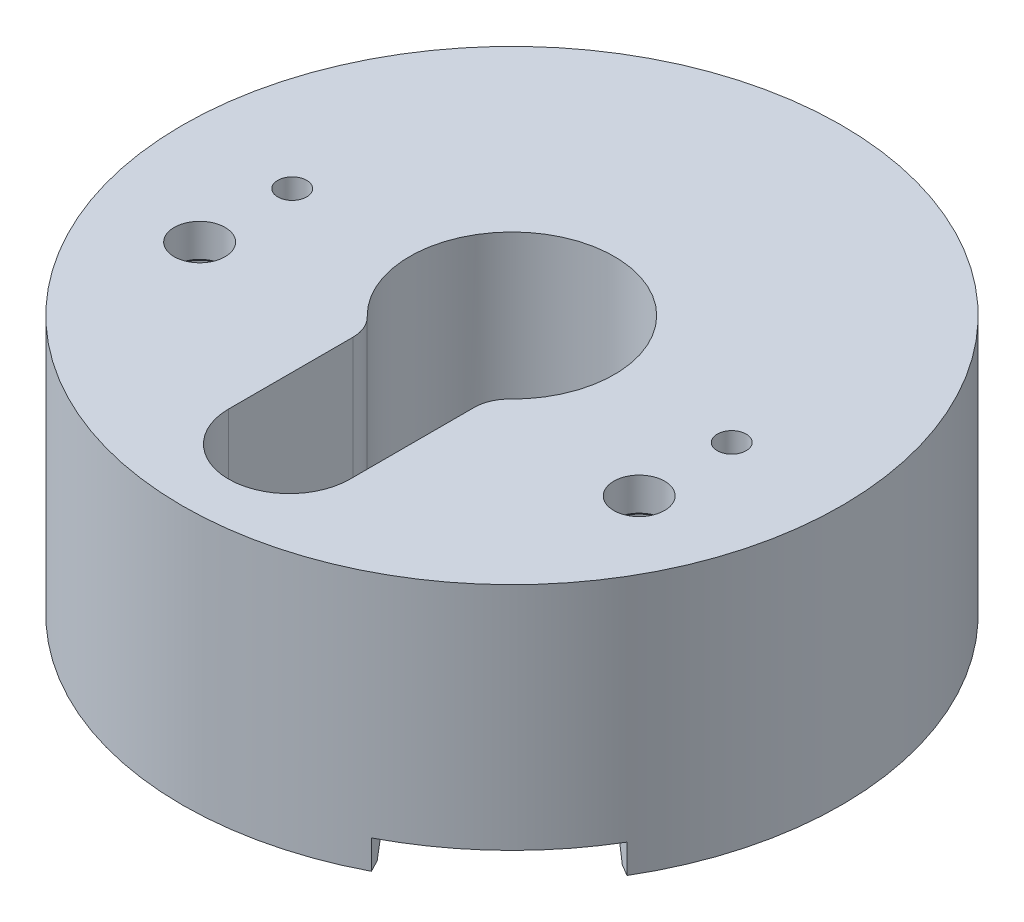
SolidWorks part; units mm, degrees
ref_plane "XY - Vorne" through (0, 0, 0) normal (0, 0, 1) x (1, 0, 0)
ref_plane "XZ - Oben" through (0, 0, 0) normal (0, 1, 0) x (1, 0, 0)
ref_plane "YZ - Rechts" through (0, 0, 0) normal (1, 0, 0) x (0, 0, -1)
sketch "Skizze1" plane through (0, 0, 0) normal (0, 1, 0) x (1, 0, 0)
  circle A0 centre (0, 0) radius 28.5
  dimension "D1" = 57
extrude "Aufsatz-Linear austragen1" add sketch "Skizze1" along normal blind 22.4
sketch "Skizze2" plane through (0, 0, 0) normal (0, -1, 0) x (1, 0, 0)
  circle A0 centre (0, 0) radius 27.325
  circle A1 centre (0, 0) radius 28.5 construction
  dimension "D1" = 54.65
extrude "Schnitt-Linear austragen1" cut sketch "Skizze2" against normal blind 2.5 draft 27
sketch "Skizze3" plane through (0, 22.4, 0) normal (0, 1, 0) x (1, 0, 0)
  circle A0 centre (0, 0) radius 25.35
  circle A1 centre (0, 0) radius 28.5 construction
  dimension "D1" = 50.7
extrude "Schnitt-Linear austragen2" [suppressed] cut sketch "Skizze3" against normal blind 2
sketch "Skizze4" plane through (0, 2.5, 0) normal (0, -1, 0) x (-1, 0, 0)
  line L0 (-19, 0) -> (19, 0) construction
  line L2 (0, 0) -> (0, -1.9579) construction
  point P0 (-19, 0)
  point P2 (19, 0)
  dimension "D1" = 38
hole_wizard "Ø2.5 (2.5) Durchmesser Bohrung1" positions "Skizze4" profile "Skizze5" hole size "Ø2.5" standard "DIN"
sketch "Skizze5" plane through (19, 2.5, 0) normal (1, 0, 0) x (0, 0, -1)
  line L0 (0, 0) -> (0, 19.9)
  line L1 (0, 19.9) -> (1.25, 19.9)
  line L2 (1.25, 19.9) -> (1.25, 0.15)
  line L3 (1.25, 0.15) -> (1.4, 0)
  line L5 (1.4, 0) -> (0, 0)
  line L6 (-1.25, 0.15) -> (-1.4, 0) construction
  line L11 (0, -6.35) -> (0, 107.95) construction
  dimension "Bohrerdurchmesser" = 2.5
  dimension "Bohrungstiefe" = 19.9
  dimension "Senkdurchmesser2 (Oben)" = 2.8
  dimension "Senkwinkel2 (Oben)" = 90
sketch "Skizze6" plane through (0, 22.4, 0) normal (0, 1, 0) x (1, 0, 0)
  line L0 (-5.25, -7.1246) -> (-5.25, -19.25)
  line L1 (5.25, -7.1246) -> (5.25, -19.25)
  line L2 (-5.25, -7.1246) -> (5.25, -7.1246) construction
  line L3 (-19, 0) -> (19, 0) construction
  line L4 (0, -7.1246) -> (0, 0) construction
  arc A0 (5.25, -7.1246) -> (-5.25, -7.1246) centre (0, 0) ccw
  arc A2 (-5.25, -19.25) -> (5.25, -19.25) centre (0, -19.25) ccw
  circle A3 centre (0, 0) radius 28.5 construction
  point P14 (0, -24.5)
  dimension "D1" = 17.7
  dimension "D2" = 10.5
  dimension "D3" = 24.5
extrude "Schnitt-Linear austragen3" cut sketch "Skizze6" against normal blind 14
sketch "Skizze7" plane through (0, 8.4, 0) normal (0, 1, 0) x (1, 0, 0)
  circle A0 centre (0, 0) radius 8.85
  arc A1 (5.25, -7.1246) -> (-5.25, -7.1246) centre (0, 0) ccw construction
extrude "Schnitt-Linear austragen4" cut sketch "Skizze7" against normal through all
sketch "Skizze9" plane through (0, 2.5, 0) normal (0, -1, 0) x (-1, 0, 0)
  line L0 (0, 0) -> (-19, 0) construction
  line L2 (0, 0) -> (0, -12.6036) construction
  circle A0 centre (0, 0) radius 8.85 construction
  point P0 (-19, -8)
  point P2 (19, -8)
  dimension "D1" = 38
  dimension "D2" = 8
hole_wizard "Formsenkung für M4 Linsensenkschraube mit Schlitz1" positions "Skizze9" profile "Skizze10" countersink size "M4" standard "DIN"
sketch "Skizze10" plane through (19, 2.5, 8) normal (1, 0, 0) x (0, 0, -1)
  line L0 (0, 0) -> (0, 16.8)
  line L1 (0, 16.8) -> (2.54, 16.8)
  line L2 (2.54, 16.8) -> (2.54, 2.36)
  line L3 (2.54, 2.36) -> (3.6, 1.3)
  line L4 (3.6, 1.3) -> (3.6, 0)
  line L6 (3.6, 0) -> (0, 0)
  line L7 (-2.54, 2.36) -> (-3.6, 1.3) construction
  line L10 (0, 16.8) -> (-2.54, 16.8) construction
  line L11 (0, -6.35) -> (0, 107.95) construction
  dimension "Bohrerdurchmesser" = 5.08
  dimension "Bohrungstiefe" = 16.8
  dimension "Senkdurchmesser2" = 7.2
  dimension "Senkwinkel2" = 90
  dimension "Spitzenwinkel" = 180
  dimension "Kopfspielraum" = 1.3
sketch "Skizze8" plane through (0, 2.5, 0) normal (0, -1, 0) x (1, 0, 0)
  line L0 (0, 0) -> (19.9564, 16.7454) construction
  line L1 (0, 0) -> (26.0512, 0) construction
  line L2 (0, 0) -> (22.3975, 13.3048) construction
  line L3 (22.3975, 13.3048) -> (24.5028, 14.5554)
  line L4 (0, 0) -> (16.9919, 19.7469) construction
  line L5 (16.9919, 19.7469) -> (18.5892, 21.6031) construction
  line L6 (24.5028, 14.5554) -> (18.5892, 21.6031) construction
  line L7 (19.9564, 16.7454) -> (21.546, 18.0793) construction
  line L8 (21.546, 18.0793) -> (21.8323, 18.3194) construction
  line L9 (21.8323, 18.3194) -> (13.1378, 25.2913) construction
  line L10 (13.1378, 25.2913) -> (12.0089, 23.1182)
  line L11 (0, 0) -> (12.0089, 23.1182) construction
  circle A0 centre (0, 0) radius 26.0512 construction
  circle A4 centre (0, 0) radius 28.5 construction
  arc A5 (24.5028, 14.5554) -> (13.1378, 25.2913) centre (0, 0) ccw
  arc A6 (22.3975, 13.3048) -> (12.0089, 23.1182) centre (0, 0) ccw
  point P4 (21.546, 18.0793)
  dimension "D1" = 40
  dimension "D2" = 9.2
  dimension "D4" = 62.55
extrude "Schnitt-Linear austragen5" cut sketch "Skizze8" along normal up to surface (2.5 mm away)
fillet "Verrundung1" radius 3 2 edges at (-5.25, 15.4, 7.1246) (5.25, 15.4, 7.1246)
fillet "Verrundung2" radius 1 1 edges at (0, 2.5, -8.85)
sketch "Skizze11" plane through (0, 19.3, 0) normal (0, -1, 0) x (-1, 0, 0)
  point P0 (-19, -8)
  point P3 (19, -8)
hole_wizard "Ø4.4 (4.4) Durchmesser Bohrung1" positions "Skizze11" profile "Skizze12" hole size "Ø4.4" standard "DIN"
sketch "Skizze12" plane through (19, 19.3, 8) normal (1, 0, 0) x (0, 0, -1)
  line L0 (0, 0) -> (0, 18.1219)
  line L1 (0, 18.1219) -> (2.2, 16.8)
  line L2 (2.2, 16.8) -> (2.2, 0.25)
  line L3 (2.2, 0.25) -> (2.45, 0)
  line L5 (2.45, 0) -> (0, 0)
  line L6 (-2.2, 0.25) -> (-2.45, 0) construction
  line L10 (0, 18.1219) -> (-2.2, 16.8) construction
  line L11 (0, -6.35) -> (0, 107.95) construction
  dimension "Bohrerdurchmesser" = 4.4
  dimension "Bohrungstiefe" = 16.8
  dimension "Senkdurchmesser2 (Oben)" = 4.9
  dimension "Senkwinkel2 (Oben)" = 90
  dimension "Spitzenwinkel" = 118
fillet "Verrundung3" radius 0.4 2 edges at (-19, 2.5, 4.4) (19, 2.5, 4.4)
fillet "Verrundung4" radius 0.4 1 edges at (19, 4.86, 5.46)
